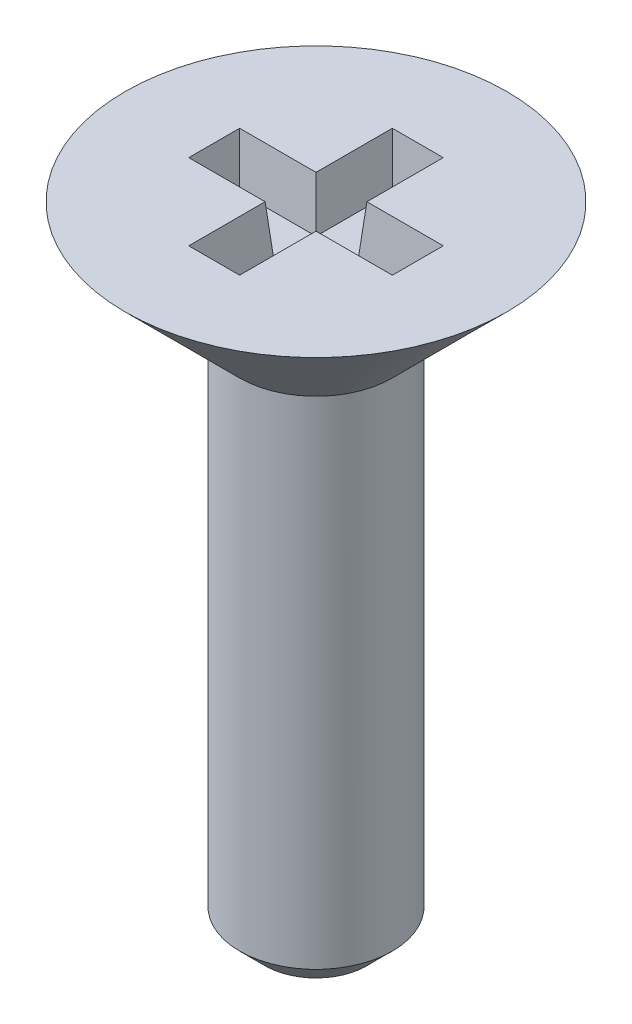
SolidWorks part; units mm, degrees
ref_plane "Front Plane" through (0, 0, 0) normal (0, 0, 1) x (1, 0, 0)
ref_plane "Top Plane" through (0, 0, 0) normal (0, 1, 0) x (1, 0, 0)
ref_plane "Right Plane" through (0, 0, 0) normal (1, 0, 0) x (0, 0, -1)
sketch "Sketch1" plane through (0, 0, 0) normal (0, 0, 1) x (1, 0, 0)
  line L0 (0, 0) -> (0, -56.0917) construction
  line L1 (0, 0) -> (-3, 0)
  line L2 (-3, 0) -> (-3, 20.5)
  line L3 (-3, 20.5) -> (-7.5, 25)
  line L4 (-7.5, 25) -> (0, 25)
  line L5 (0, 25) -> (0, 0)
  dimension "D1" = 6
  dimension "D2" = 45
  dimension "D3" = 4.5
  dimension "D4" = 25
revolve "Revolve1" add sketch "Sketch1" angle 360 about L0
sketch "Sketch2" plane through (0, 25, 0) normal (0, 1, 0) x (1, 0, 0)
  line L0 (-4, 1) -> (-1, 1)
  line L1 (-4, -1) -> (4, -1) construction
  line L2 (-4, -1) -> (-4, 1)
  line L3 (-4, 1) -> (4, 1) construction
  line L4 (4, -1) -> (4, 1)
  line L5 (-4, -1) -> (4, 1) construction
  line L6 (-4, 1) -> (4, -1) construction
  line L7 (-1, -4) -> (1, -4)
  line L8 (-1, -4) -> (-1, 4) construction
  line L9 (-1, 4) -> (1, 4)
  line L10 (1, -4) -> (1, 4) construction
  line L11 (-1, -4) -> (1, 4) construction
  line L12 (-1, 4) -> (1, -4) construction
  line L13 (-1, 1) -> (-1, 4)
  line L14 (1, 4) -> (1, 1)
  line L15 (1, 1) -> (4, 1)
  line L16 (4, -1) -> (1, -1)
  line L17 (1, -1) -> (1, -4)
  line L18 (-1, -4) -> (-1, -1)
  line L19 (-1, -1) -> (-4, -1)
  point P0 (0, 0)
  point P6 (0, 0)
  dimension "D1" = 2
  dimension "D2" = 2
  dimension "D3" = 8
  dimension "D4" = 8
extrude "Cut-Extrude1" cut sketch "Sketch2" against normal blind 2 draft 5
chamfer "Chamfer1" distance 1 angle 45 1 edges at (0, 0, 3)
